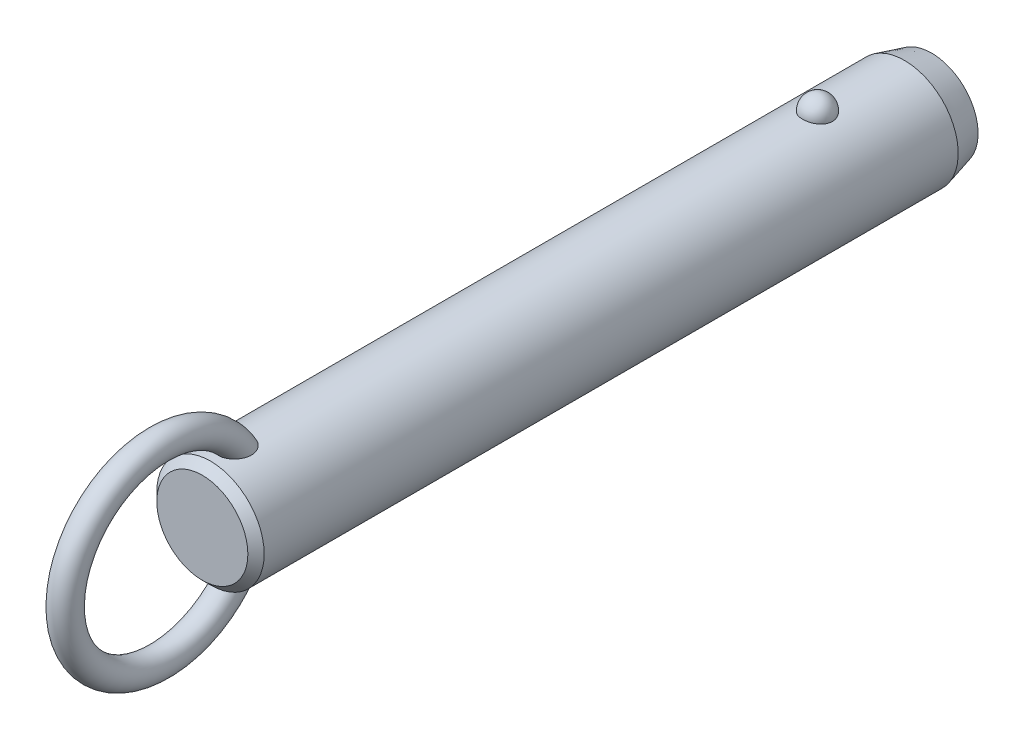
SolidWorks part; units mm, degrees
ref_plane "Front Plane" through (0, 0, 0) normal (0, 0, 1) x (1, 0, 0)
ref_plane "Top Plane" through (0, 0, 0) normal (0, 1, 0) x (1, 0, 0)
ref_plane "Right Plane" through (0, 0, 0) normal (1, 0, 0) x (0, 0, -1)
sketch "Sketch2" plane through (0, 0, 0) normal (0, 0, 1) x (1, 0, 0)
  circle A0 centre (0, 0) radius 7.9
  point P3 (0, 7.9)
  dimension "D1" = 15.8
extrude "Boss-Extrude1" add sketch "Sketch2" along normal blind 78.8
sketch "Sketch3" plane through (0, 0, 0) normal (0, 0, -1) x (-1, 0, 0)
  circle A0 centre (0, 0) radius 7.9
  dimension "D1" = 15.8
extrude "Boss-Extrude2" add sketch "Sketch3" along normal blind 19
chamfer "Chamfer1" distance 4 angle 15 1 edges at (-7.9, 0, -19)
sketch "Sketch12" plane through (0, 0, 0) normal (1, 0, 0) x (0, 0, -1)
  line L0 (-78.8, 7.9) -> (-78.8, -7.9) construction
  point P0 (-78.8, 0)
sketch "Sketch13" plane through (0, 0, 0) normal (1, 0, 0) x (0, 0, -1)
  circle A0 centre (-94.65, 0) radius 15.85
  point P2 (-78.8, 0)
  dimension "D1" = 31.7
sketch "Sketch14" plane through (0, 0, 0) normal (0, 1, 0) x (1, 0, 0)
  circle A0 centre (0, -80.8) radius 2
  point P2 (0, -78.8)
  dimension "D1" = 4
sweep "Sweep1" add profiles "Sketch14" path "Sketch13"
sketch "Sketch15" plane through (0, 0, 78.8) normal (0, 0, 1) x (1, 0, 0)
  circle A0 centre (0, 0) radius 7.9
  dimension "D1" = 15.8
extrude "Boss-Extrude3" add sketch "Sketch15" along normal blind 9.52
chamfer "Chamfer2" distance 1.2 angle 45 1 edges at (7.9, 0, 88.32)
sketch "Sketch18" plane through (0, 0, 0) normal (1, 0, 0) x (0, 0, -1)
  line L0 (15, 7.9) -> (-80.9091, 7.9) construction
  line L1 (2.2, 10.1) -> (2.2, 5.7)
  line L2 (-80.9091, -7.9) -> (15, -7.9) construction
  arc A0 (2.2, 10.1) -> (2.2, 5.7) centre (2.2, 7.9) ccw
  point P4 (0, 7.9)
  dimension "D1" = 18
revolve "Revolve1" add sketch "Sketch18" angle 360 about L1
